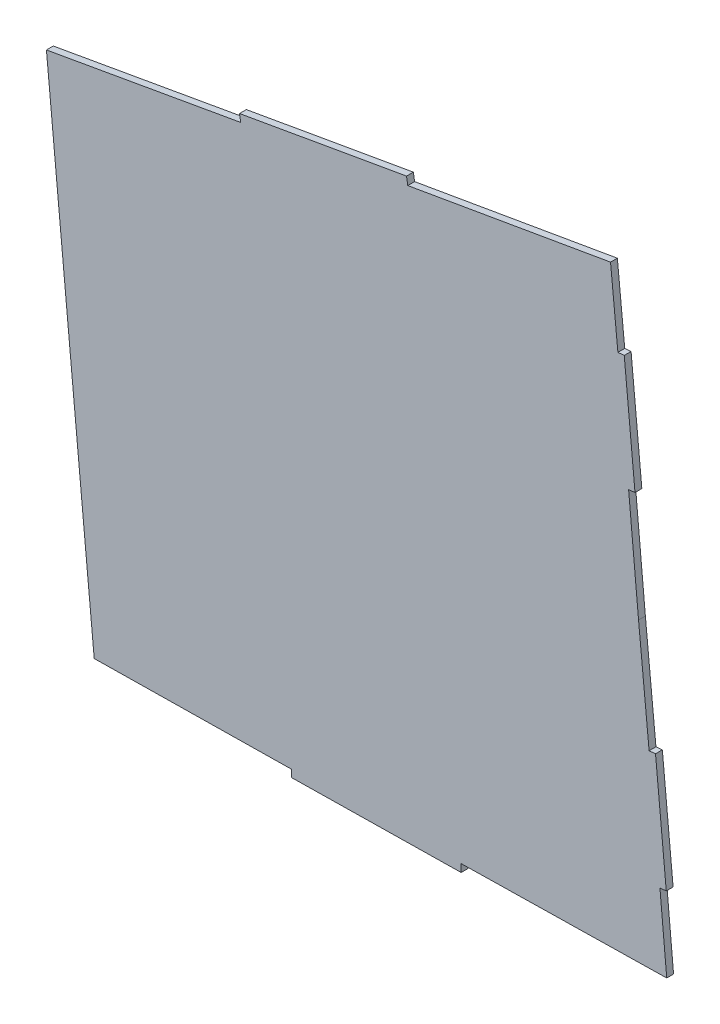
SolidWorks part; units mm, degrees
ref_plane "Front Plane" through (0, 0, 0) normal (0, 0, 1) x (1, 0, 0)
ref_plane "Top Plane" through (0, 0, 0) normal (0, 1, 0) x (1, 0, 0)
ref_plane "Right Plane" through (0, 0, 0) normal (1, 0, 0) x (0, 0, -1)
sketch "Sketch1" plane through (0, 0, 0) normal (0, 0, 1) x (1, 0, 0)
  line L0 (95.9446, 128.0565) -> (58.4037, 121.5539) construction
  line L1 (141.1287, 135.709) -> (142.8536, 117.5392) construction
  line L2 (142.9164, 117.5452) -> (144.3312, 117.6795)
  line L3 (142.8536, 117.5392) -> (144.3312, 117.6795) construction
  line L4 (144.3312, 117.6795) -> (146.7317, 92.3932)
  line L5 (142.9164, 117.5452) -> (141.2762, 134.1549)
  line L6 (146.7317, 92.3932) -> (145.305, 92.2577)
  line L7 (20.8456, 56.1532) -> (250.2476, 77.9311) construction
  line L8 (70.151, 0.6907) -> (70.1831, -0.9208)
  line L9 (70.1831, -0.9208) -> (107.979, -0.3369)
  line L10 (147.5197, 68.1788) -> (145.305, 92.2577)
  line L11 (107.979, -0.3369) -> (107.9377, 1.3797)
  line L12 (107.9377, 1.3797) -> (153.8025, 2.2065)
  line L13 (70.151, 0.6907) -> (26.1702, 0.0656)
  line L14 (147.5197, 68.1788) -> (149.8755, 44.1132)
  line L15 (151.3022, 44.2487) -> (149.8755, 44.1132)
  line L16 (152.2879, 18.8281) -> (153.8025, 2.2065)
  line L17 (153.7028, 18.9624) -> (151.3022, 44.2487)
  line L18 (26.1702, 0.0656) -> (15.521, 112.2408)
  line L19 (152.2879, 18.8281) -> (153.7028, 18.9624)
  line L20 (58.8338, 119.9027) -> (15.521, 112.2408)
  line L21 (96.0752, 126.3364) -> (141.2762, 134.1549)
  line L22 (95.7927, 128.0302) -> (96.0752, 126.3364)
  line L23 (58.5621, 121.4916) -> (95.7927, 128.0302)
  line L24 (58.8338, 119.9027) -> (58.5621, 121.4916)
extrude "Boss-Extrude1" add sketch "Sketch1" along normal blind 1.524
